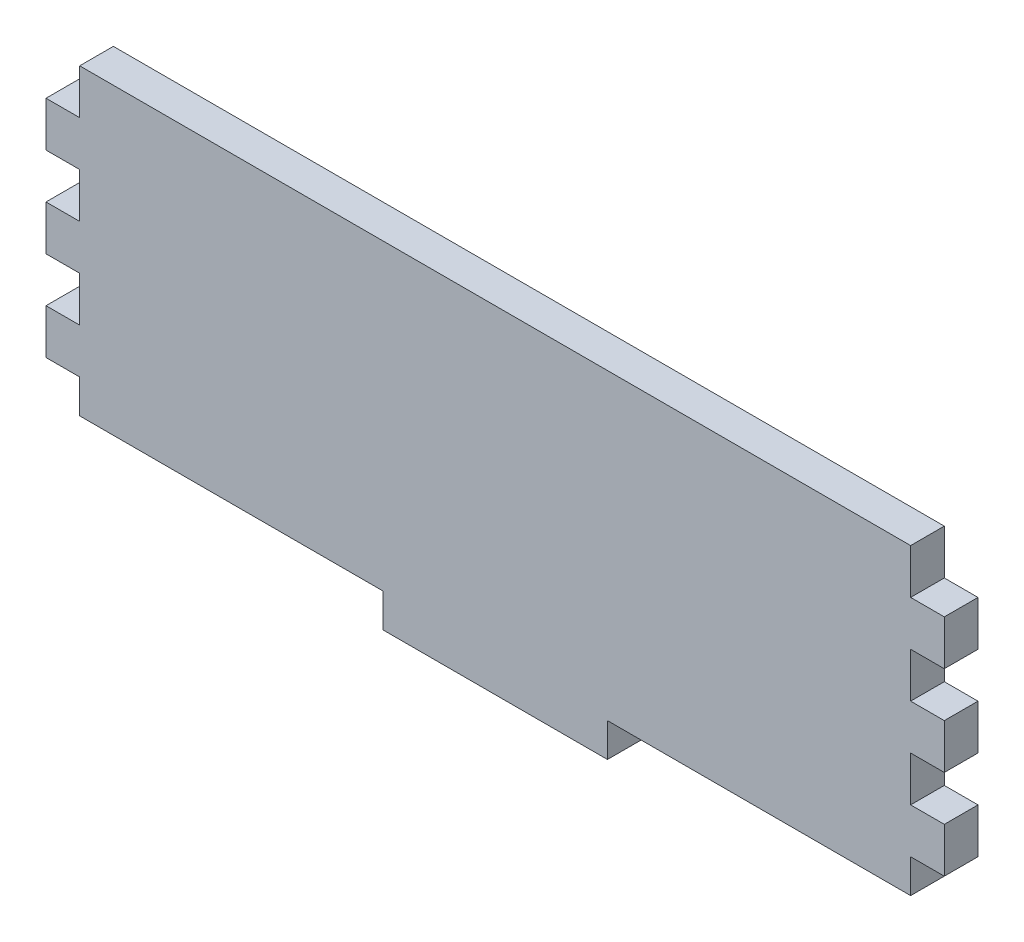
SolidWorks part; units mm, degrees
ref_plane "Alzado" through (0, 0, 0) normal (0, 0, 1) x (1, 0, 0)
ref_plane "Planta" through (0, 0, 0) normal (0, 1, 0) x (1, 0, 0)
ref_plane "Vista lateral" through (0, 0, 0) normal (1, 0, 0) x (0, 0, -1)
sketch "Croquis1" plane through (0, 0, 0) normal (0, 0, 1) x (1, 0, 0)
  line L0 (-200, -60) -> (-50, -60)
  line L1 (50, -75) -> (-50, -75)
  line L2 (200, -60) -> (200, 75)
  line L3 (200, 75) -> (-200, 75)
  line L4 (-200, -60) -> (-200, 75)
  line L5 (200, -75) -> (-200, 75) construction
  line L6 (200, 75) -> (-200, -75) construction
  line L7 (-50, -60) -> (-50, -75)
  line L8 (50, -75) -> (50, -60)
  line L9 (50, -60) -> (200, -60)
  line L10 (-200, -60) -> (-200, -75) construction
  line L11 (200, -60) -> (200, -75)
  line L12 (200, -75) -> (-200, -75) construction
  point P0 (0, 0)
  point P11 (0, -75)
extrude "Saliente-Extruir1" add sketch "Croquis1" along normal blind 15 contours L2 L3 L4 L0 L7 L1 L8 L9
sketch "Croquis2" plane through (0, 0, 15) normal (0, 0, 1) x (1, 0, 0)
  line L0 (-200, -60) -> (-200, 75) construction
  line L1 (-200, 75) -> (-185, 75)
  line L2 (-200, 75) -> (-200, 55)
  line L3 (-200, 55) -> (-185, 55)
  line L4 (-185, 75) -> (-185, 55)
  line L5 (-200, 35) -> (-185, 35)
  line L6 (-200, 35) -> (-200, 15)
  line L7 (-200, 15) -> (-185, 15)
  line L8 (-185, 35) -> (-185, 15)
  line L9 (0, 0) -> (0, 75) construction
  line L10 (-200, -5) -> (-185, -5)
  line L11 (-200, -5) -> (-200, -25)
  line L12 (-200, -25) -> (-185, -25)
  line L13 (-185, -5) -> (-185, -25)
  line L14 (200, 75) -> (-200, 75) construction
  line L15 (185, -5) -> (185, -25)
  line L16 (200, -25) -> (185, -25)
  line L17 (200, -5) -> (200, -25)
  line L18 (200, -5) -> (185, -5)
  line L19 (185, 35) -> (185, 15)
  line L20 (200, 15) -> (185, 15)
  line L21 (200, 35) -> (200, 15)
  line L22 (200, 35) -> (185, 35)
  line L23 (185, 75) -> (185, 55)
  line L24 (200, 55) -> (185, 55)
  line L25 (200, 75) -> (200, 55)
  line L26 (200, 75) -> (185, 75)
  line L27 (-200, -45) -> (-185, -45)
  line L28 (-185, -45) -> (-185, -60)
  line L29 (-200, -60) -> (-50, -60) construction
  line L30 (-185, -60) -> (-200, -60)
  line L31 (-200, -60) -> (-200, -45)
  line L32 (200, -60) -> (200, -45)
  line L33 (185, -60) -> (200, -60)
  line L34 (185, -45) -> (185, -60)
  line L35 (200, -45) -> (185, -45)
extrude "Cortar-Extruir1" cut sketch "Croquis2" against normal through all
equation "\"profbase\"= 400"
equation "\"anchbase\"= 400"
equation "\"thicknes\"=15"
equation "\"altura\"=150"
equation "\"D1@Saliente-Extruir1\"=\"thicknes\""
equation "\"D1@Croquis1\"=\"altura\""
equation "\"D2@Croquis1\"=\"anchbase\""
equation "\"D3@Croquis1\"=\"thicknes\""
equation "\"clearens\"=0"
equation "\"joind1\"=100"
equation "\"D4@Croquis1\"=\"joind1\""
equation "\"D1@Croquis2\"=\"thicknes\""
